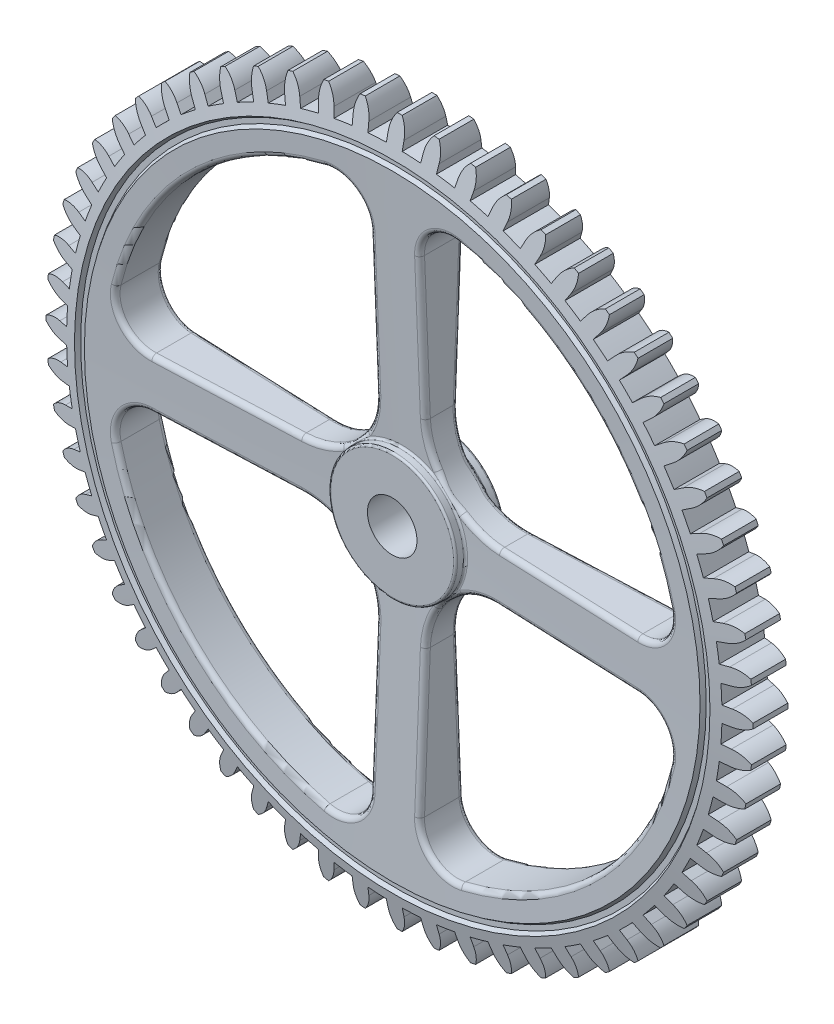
SolidWorks part; units mm, degrees
ref_plane "Front Plane" through (0, 0, 0) normal (0, 0, 1) x (1, 0, 0)
ref_plane "Top Plane" through (0, 0, 0) normal (0, 1, 0) x (1, 0, 0)
ref_plane "Right Plane" through (0, 0, 0) normal (1, 0, 0) x (0, 0, -1)
sketch "Sketch1" plane through (0, 0, 0) normal (1, 0, 0) x (0, 0, -1)
  line L0 (-5, 0) -> (5, 0)
  line L1 (-3.5, 71.3) -> (-5, 64.1)
  line L2 (3.5, 71.3) -> (-3.5, 71.3)
  line L3 (-5, 12.8) -> (-5, 0)
  line L4 (3.5, 71.3) -> (5, 64.1)
  line L5 (-5, 12.8) -> (-3, 12.8)
  line L6 (5, 62.1) -> (3, 12.8)
  line L7 (-4.2534, 63.6) -> (-4.2534, 62.6)
  line L8 (-5, 62.1) -> (-4.2534, 62.6)
  line L9 (-5, 64.1) -> (-4.2534, 63.6)
  line L10 (-5, 62.1) -> (-3, 12.8)
  line L11 (5, 12.8) -> (5, 0)
  line L12 (5, 62.1) -> (4.2534, 62.6)
  line L13 (4.2534, 63.6) -> (4.2534, 62.6)
  line L14 (5, 64.1) -> (4.2534, 63.6)
  line L15 (3, 12.8) -> (5, 12.8)
  line L16 (-5, 12.8) -> (5, 12.8) construction
  point P12 (-3, 12.8)
  dimension "D1" = 7
  dimension "D2" = 5
  dimension "D4" = 1.5
  dimension "D3" = 71.3
  dimension "D6" = 2
  dimension "D7" = 1
  dimension "D8" = 0.5
  dimension "D10" = 2
  dimension "D5" = 12.8
revolve "Revolve1" add sketch "Sketch1" angle 360 about L0
sketch "Sketch2" plane through (0, 0, 0) normal (0, 0, 1) x (1, 0, 0)
  line L0 (0.51, 71.2982) -> (-0.51, 71.2982)
  line L1 (5.499, 67.6268) -> (5.3161, 65.8859)
  line L2 (-1.6, 67.8311) -> (-1.6, 66.0806)
  line L3 (1.6, 67.8311) -> (1.6, 66.0806)
  line L4 (7.9599, 70.8543) -> (6.9455, 70.9609)
  line L5 (8.6815, 67.2923) -> (8.4985, 65.5514)
  line L6 (12.5378, 66.6815) -> (12.1739, 64.9693)
  line L7 (15.3226, 69.6341) -> (14.3249, 69.8462)
  line L8 (15.6679, 66.0162) -> (15.304, 64.304)
  line L9 (19.4393, 65.0057) -> (18.8983, 63.3408)
  line L10 (22.5174, 67.651) -> (21.5473, 67.9662)
  line L11 (22.4827, 64.0168) -> (21.9417, 62.352)
  line L12 (26.1277, 62.6176) -> (25.4157, 61.0184)
  line L13 (29.4655, 64.9267) -> (28.5337, 65.3416)
  line L14 (29.0511, 61.316) -> (28.3391, 59.7169)
  line L15 (32.5299, 59.5435) -> (31.6547, 58.0275)
  line L16 (36.0908, 61.491) -> (35.2074, 62.001)
  line L17 (35.3012, 57.9435) -> (34.426, 56.4275)
  line L18 (38.5757, 55.817) -> (37.5468, 54.4008)
  line L19 (42.3206, 57.3817) -> (41.4954, 57.9812)
  line L20 (41.1646, 53.9361) -> (40.1356, 52.5199)
  line L21 (44.1989, 51.479) -> (43.0275, 50.1781)
  line L22 (48.0868, 52.6436) -> (47.3288, 53.3261)
  line L23 (46.5769, 49.3377) -> (45.4056, 48.0369)
  line L24 (49.3377, 46.5769) -> (48.0369, 45.4056)
  line L25 (53.3261, 47.3288) -> (52.6436, 48.0868)
  line L26 (51.479, 44.1989) -> (50.1781, 43.0275)
  line L27 (53.9361, 41.1646) -> (52.5199, 40.1356)
  line L28 (57.9812, 41.4954) -> (57.3817, 42.3206)
  line L29 (55.817, 38.5757) -> (54.4008, 37.5468)
  line L30 (57.9435, 35.3012) -> (56.4275, 34.426)
  line L31 (62.001, 35.2074) -> (61.491, 36.0908)
  line L32 (59.5435, 32.5299) -> (58.0275, 31.6547)
  line L33 (61.316, 29.0511) -> (59.7169, 28.3391)
  line L34 (65.3416, 28.5337) -> (64.9267, 29.4655)
  line L35 (62.6176, 26.1277) -> (61.0184, 25.4157)
  line L36 (64.0168, 22.4827) -> (62.352, 21.9417)
  line L37 (67.9662, 21.5473) -> (67.651, 22.5174)
  line L38 (65.0057, 19.4393) -> (63.3408, 18.8983)
  line L39 (66.0162, 15.6679) -> (64.304, 15.304)
  line L40 (69.8462, 14.3249) -> (69.6341, 15.3226)
  line L41 (66.6815, 12.5378) -> (64.9693, 12.1739)
  line L42 (67.2923, 8.6815) -> (65.5514, 8.4985)
  line L43 (70.9609, 6.9455) -> (70.8543, 7.9599)
  line L44 (67.6268, 5.499) -> (65.8859, 5.3161)
  line L45 (67.8311, 1.6) -> (66.0806, 1.6)
  line L46 (71.2982, -0.51) -> (71.2982, 0.51)
  line L47 (67.8311, -1.6) -> (66.0806, -1.6)
  line L48 (67.6268, -5.499) -> (65.8859, -5.3161)
  line L49 (70.8543, -7.9599) -> (70.9609, -6.9455)
  line L50 (67.2923, -8.6815) -> (65.5514, -8.4985)
  line L51 (66.6815, -12.5378) -> (64.9693, -12.1739)
  line L52 (69.6341, -15.3226) -> (69.8462, -14.3249)
  line L53 (66.0162, -15.6679) -> (64.304, -15.304)
  line L54 (65.0057, -19.4393) -> (63.3408, -18.8983)
  line L55 (67.651, -22.5174) -> (67.9662, -21.5473)
  line L56 (64.0168, -22.4827) -> (62.352, -21.9417)
  line L57 (62.6176, -26.1277) -> (61.0184, -25.4157)
  line L58 (64.9267, -29.4655) -> (65.3416, -28.5337)
  line L59 (61.316, -29.0511) -> (59.7169, -28.3391)
  line L60 (59.5435, -32.5299) -> (58.0275, -31.6547)
  line L61 (61.491, -36.0908) -> (62.001, -35.2074)
  line L62 (57.9435, -35.3012) -> (56.4275, -34.426)
  line L63 (55.817, -38.5757) -> (54.4008, -37.5468)
  line L64 (57.3817, -42.3206) -> (57.9812, -41.4954)
  line L65 (53.9361, -41.1646) -> (52.5199, -40.1356)
  line L66 (51.479, -44.1989) -> (50.1781, -43.0275)
  line L67 (52.6436, -48.0868) -> (53.3261, -47.3288)
  line L68 (49.3377, -46.5769) -> (48.0369, -45.4056)
  line L69 (46.5769, -49.3377) -> (45.4056, -48.0369)
  line L70 (47.3288, -53.3261) -> (48.0868, -52.6436)
  line L71 (44.1989, -51.479) -> (43.0275, -50.1781)
  line L72 (41.1646, -53.9361) -> (40.1356, -52.5199)
  line L73 (41.4954, -57.9812) -> (42.3206, -57.3817)
  line L74 (38.5757, -55.817) -> (37.5468, -54.4008)
  line L75 (35.3012, -57.9435) -> (34.426, -56.4275)
  line L76 (35.2074, -62.001) -> (36.0908, -61.491)
  line L77 (32.5299, -59.5435) -> (31.6547, -58.0275)
  line L78 (29.0511, -61.316) -> (28.3391, -59.7169)
  line L79 (28.5337, -65.3416) -> (29.4655, -64.9267)
  line L80 (26.1277, -62.6176) -> (25.4157, -61.0184)
  line L81 (22.4827, -64.0168) -> (21.9417, -62.352)
  line L82 (21.5473, -67.9662) -> (22.5174, -67.651)
  line L83 (19.4393, -65.0057) -> (18.8983, -63.3408)
  line L84 (15.6679, -66.0162) -> (15.304, -64.304)
  line L85 (14.3249, -69.8462) -> (15.3226, -69.6341)
  line L86 (12.5378, -66.6815) -> (12.1739, -64.9693)
  line L87 (8.6815, -67.2923) -> (8.4985, -65.5514)
  line L88 (6.9455, -70.9609) -> (7.9599, -70.8543)
  line L89 (5.499, -67.6268) -> (5.3161, -65.8859)
  line L90 (1.6, -67.8311) -> (1.6, -66.0806)
  line L91 (-0.51, -71.2982) -> (0.51, -71.2982)
  line L92 (-1.6, -67.8311) -> (-1.6, -66.0806)
  line L93 (-5.499, -67.6268) -> (-5.3161, -65.8859)
  line L94 (-7.9599, -70.8543) -> (-6.9455, -70.9609)
  line L95 (-8.6815, -67.2923) -> (-8.4985, -65.5514)
  line L96 (-12.5378, -66.6815) -> (-12.1739, -64.9693)
  line L97 (-15.3226, -69.6341) -> (-14.3249, -69.8462)
  line L98 (-15.6679, -66.0162) -> (-15.304, -64.304)
  line L99 (-19.4393, -65.0057) -> (-18.8983, -63.3408)
  line L100 (-22.5174, -67.651) -> (-21.5473, -67.9662)
  line L101 (-22.4827, -64.0168) -> (-21.9417, -62.352)
  line L102 (-26.1277, -62.6176) -> (-25.4157, -61.0184)
  line L103 (-29.4655, -64.9267) -> (-28.5337, -65.3416)
  line L104 (-29.0511, -61.316) -> (-28.3391, -59.7169)
  line L105 (-32.5299, -59.5435) -> (-31.6547, -58.0275)
  line L106 (-36.0908, -61.491) -> (-35.2074, -62.001)
  line L107 (-35.3012, -57.9435) -> (-34.426, -56.4275)
  line L108 (-38.5757, -55.817) -> (-37.5468, -54.4008)
  line L109 (-42.3206, -57.3817) -> (-41.4954, -57.9812)
  line L110 (-41.1646, -53.9361) -> (-40.1356, -52.5199)
  line L111 (-44.1989, -51.479) -> (-43.0275, -50.1781)
  line L112 (-48.0868, -52.6436) -> (-47.3288, -53.3261)
  line L113 (-46.5769, -49.3377) -> (-45.4056, -48.0369)
  line L114 (-49.3377, -46.5769) -> (-48.0369, -45.4056)
  line L115 (-53.3261, -47.3288) -> (-52.6436, -48.0868)
  line L116 (-51.479, -44.1989) -> (-50.1781, -43.0275)
  line L117 (-53.9361, -41.1646) -> (-52.5199, -40.1356)
  line L118 (-57.9812, -41.4954) -> (-57.3817, -42.3206)
  line L119 (-55.817, -38.5757) -> (-54.4008, -37.5468)
  line L120 (-57.9435, -35.3012) -> (-56.4275, -34.426)
  line L121 (-62.001, -35.2074) -> (-61.491, -36.0908)
  line L122 (-59.5435, -32.5299) -> (-58.0275, -31.6547)
  line L123 (-61.316, -29.0511) -> (-59.7169, -28.3391)
  line L124 (-65.3416, -28.5337) -> (-64.9267, -29.4655)
  line L125 (-62.6176, -26.1277) -> (-61.0184, -25.4157)
  line L126 (-64.0168, -22.4827) -> (-62.352, -21.9417)
  line L127 (-67.9662, -21.5473) -> (-67.651, -22.5174)
  line L128 (-65.0057, -19.4393) -> (-63.3408, -18.8983)
  line L129 (-66.0162, -15.6679) -> (-64.304, -15.304)
  line L130 (-69.8462, -14.3249) -> (-69.6341, -15.3226)
  line L131 (-66.6815, -12.5378) -> (-64.9693, -12.1739)
  line L132 (-67.2923, -8.6815) -> (-65.5514, -8.4985)
  line L133 (-70.9609, -6.9455) -> (-70.8543, -7.9599)
  line L134 (-67.6268, -5.499) -> (-65.8859, -5.3161)
  line L135 (-67.8311, -1.6) -> (-66.0806, -1.6)
  line L136 (-71.2982, 0.51) -> (-71.2982, -0.51)
  line L137 (-67.8311, 1.6) -> (-66.0806, 1.6)
  line L138 (-67.6268, 5.499) -> (-65.8859, 5.3161)
  line L139 (-70.8543, 7.9599) -> (-70.9609, 6.9455)
  line L140 (-67.2923, 8.6815) -> (-65.5514, 8.4985)
  line L141 (-66.6815, 12.5378) -> (-64.9693, 12.1739)
  line L142 (-69.6341, 15.3226) -> (-69.8462, 14.3249)
  line L143 (-66.0162, 15.6679) -> (-64.304, 15.304)
  line L144 (-65.0057, 19.4393) -> (-63.3408, 18.8983)
  line L145 (-67.651, 22.5174) -> (-67.9662, 21.5473)
  line L146 (-64.0168, 22.4827) -> (-62.352, 21.9417)
  line L147 (-62.6176, 26.1277) -> (-61.0184, 25.4157)
  line L148 (-64.9267, 29.4655) -> (-65.3416, 28.5337)
  line L149 (-61.316, 29.0511) -> (-59.7169, 28.3391)
  line L150 (-59.5435, 32.5299) -> (-58.0275, 31.6547)
  line L151 (-61.491, 36.0908) -> (-62.001, 35.2074)
  line L152 (-57.9435, 35.3012) -> (-56.4275, 34.426)
  line L153 (-55.817, 38.5757) -> (-54.4008, 37.5468)
  line L154 (-57.3817, 42.3206) -> (-57.9812, 41.4954)
  line L155 (-53.9361, 41.1646) -> (-52.5199, 40.1356)
  line L156 (-51.479, 44.1989) -> (-50.1781, 43.0275)
  line L157 (-52.6436, 48.0868) -> (-53.3261, 47.3288)
  line L158 (-49.3377, 46.5769) -> (-48.0369, 45.4056)
  line L159 (-46.5769, 49.3377) -> (-45.4056, 48.0369)
  line L160 (-47.3288, 53.3261) -> (-48.0868, 52.6436)
  line L161 (-44.1989, 51.479) -> (-43.0275, 50.1781)
  line L162 (-41.1646, 53.9361) -> (-40.1356, 52.5199)
  line L163 (-41.4954, 57.9812) -> (-42.3206, 57.3817)
  line L164 (-38.5757, 55.817) -> (-37.5468, 54.4008)
  line L165 (-35.3012, 57.9435) -> (-34.426, 56.4275)
  line L166 (-35.2074, 62.001) -> (-36.0908, 61.491)
  line L167 (-32.5299, 59.5435) -> (-31.6547, 58.0275)
  line L168 (-29.0511, 61.316) -> (-28.3391, 59.7169)
  line L169 (-28.5337, 65.3416) -> (-29.4655, 64.9267)
  line L170 (-26.1277, 62.6176) -> (-25.4157, 61.0184)
  line L171 (-22.4827, 64.0168) -> (-21.9417, 62.352)
  line L172 (-21.5473, 67.9662) -> (-22.5174, 67.651)
  line L173 (-19.4393, 65.0057) -> (-18.8983, 63.3408)
  line L174 (-15.6679, 66.0162) -> (-15.304, 64.304)
  line L175 (-14.3249, 69.8462) -> (-15.3226, 69.6341)
  line L176 (-12.5378, 66.6815) -> (-12.1739, 64.9693)
  line L177 (-8.6815, 67.2923) -> (-8.4985, 65.5514)
  line L178 (-6.9455, 70.9609) -> (-7.9599, 70.8543)
  line L179 (-5.499, 67.6268) -> (-5.3161, 65.8859)
  arc A0 (6.9455, 70.9609) -> (5.499, 67.6268) centre (11.4681, 67.0181) ccw
  arc A1 (-1.6, 66.0806) -> (1.6, 66.0806) centre (0, 0) ccw
  circle A2 centre (0, 0) radius 71.3 construction
  arc A3 (-0.51, 71.2982) -> (-1.6, 67.8311) centre (4.4, 67.8497) ccw
  arc A4 (0.51, 71.2982) -> (1.6, 67.8311) centre (-4.4, 67.8497) cw
  arc A5 (7.9599, 70.8543) -> (8.6815, 67.2923) centre (2.7164, 67.9379) cw
  arc A6 (14.3249, 69.8462) -> (12.5378, 66.6815) centre (18.4106, 65.4522) ccw
  arc A7 (15.3226, 69.6341) -> (15.6679, 66.0162) centre (9.8029, 67.2818) cw
  arc A8 (21.5473, 67.9662) -> (19.4393, 65.0057) centre (25.1513, 63.1692) ccw
  arc A9 (22.5174, 67.651) -> (22.4827, 64.0168) centre (16.7821, 65.8885) cw
  arc A10 (28.5337, 65.3416) -> (26.1277, 62.6176) centre (31.6165, 60.1941) ccw
  arc A11 (29.4655, 64.9267) -> (29.0511, 61.316) centre (23.5774, 63.7734) cw
  arc A12 (35.2074, 62.001) -> (32.5299, 59.5435) centre (37.7353, 56.5596) ccw
  arc A13 (36.0908, 61.491) -> (35.3012, 57.9435) centre (30.1143, 60.9595) cw
  arc A14 (41.4954, 57.9812) -> (38.5757, 55.817) centre (43.4407, 52.3053) ccw
  arc A15 (42.3206, 57.3817) -> (41.1646, 53.9361) centre (36.3214, 57.4778) cw
  arc A16 (47.3288, 53.3261) -> (44.1989, 51.479) centre (48.6701, 47.478) ccw
  arc A17 (48.0868, 52.6436) -> (46.5769, 49.3377) centre (42.1305, 53.3663) cw
  arc A18 (52.6436, 48.0868) -> (49.3377, 46.5769) centre (53.3663, 42.1305) ccw
  arc A19 (53.3261, 47.3288) -> (51.479, 44.1989) centre (47.478, 48.6701) cw
  arc A20 (57.3817, 42.3206) -> (53.9361, 41.1646) centre (57.4778, 36.3214) ccw
  arc A21 (57.9812, 41.4954) -> (55.817, 38.5757) centre (52.3053, 43.4407) cw
  arc A22 (61.491, 36.0908) -> (57.9435, 35.3012) centre (60.9595, 30.1143) ccw
  arc A23 (62.001, 35.2074) -> (59.5435, 32.5299) centre (56.5596, 37.7353) cw
  arc A24 (64.9267, 29.4655) -> (61.316, 29.0511) centre (63.7734, 23.5774) ccw
  arc A25 (65.3416, 28.5337) -> (62.6176, 26.1277) centre (60.1941, 31.6165) cw
  arc A26 (67.651, 22.5174) -> (64.0168, 22.4827) centre (65.8885, 16.7821) ccw
  arc A27 (67.9662, 21.5473) -> (65.0057, 19.4393) centre (63.1692, 25.1513) cw
  arc A28 (69.6341, 15.3226) -> (66.0162, 15.6679) centre (67.2818, 9.8029) ccw
  arc A29 (69.8462, 14.3249) -> (66.6815, 12.5378) centre (65.4522, 18.4106) cw
  arc A30 (70.8543, 7.9599) -> (67.2923, 8.6815) centre (67.9379, 2.7164) ccw
  arc A31 (70.9609, 6.9455) -> (67.6268, 5.499) centre (67.0181, 11.4681) cw
  arc A32 (71.2982, 0.51) -> (67.8311, 1.6) centre (67.8497, -4.4) ccw
  arc A33 (71.2982, -0.51) -> (67.8311, -1.6) centre (67.8497, 4.4) cw
  arc A34 (70.9609, -6.9455) -> (67.6268, -5.499) centre (67.0181, -11.4681) ccw
  arc A35 (70.8543, -7.9599) -> (67.2923, -8.6815) centre (67.9379, -2.7164) cw
  arc A36 (69.8462, -14.3249) -> (66.6815, -12.5378) centre (65.4522, -18.4106) ccw
  arc A37 (69.6341, -15.3226) -> (66.0162, -15.6679) centre (67.2818, -9.8029) cw
  arc A38 (67.9662, -21.5473) -> (65.0057, -19.4393) centre (63.1692, -25.1513) ccw
  arc A39 (67.651, -22.5174) -> (64.0168, -22.4827) centre (65.8885, -16.7821) cw
  arc A40 (65.3416, -28.5337) -> (62.6176, -26.1277) centre (60.1941, -31.6165) ccw
  arc A41 (64.9267, -29.4655) -> (61.316, -29.0511) centre (63.7734, -23.5774) cw
  arc A42 (62.001, -35.2074) -> (59.5435, -32.5299) centre (56.5596, -37.7353) ccw
  arc A43 (61.491, -36.0908) -> (57.9435, -35.3012) centre (60.9595, -30.1143) cw
  arc A44 (57.9812, -41.4954) -> (55.817, -38.5757) centre (52.3053, -43.4407) ccw
  arc A45 (57.3817, -42.3206) -> (53.9361, -41.1646) centre (57.4778, -36.3214) cw
  arc A46 (53.3261, -47.3288) -> (51.479, -44.1989) centre (47.478, -48.6701) ccw
  arc A47 (52.6436, -48.0868) -> (49.3377, -46.5769) centre (53.3663, -42.1305) cw
  arc A48 (48.0868, -52.6436) -> (46.5769, -49.3377) centre (42.1305, -53.3663) ccw
  arc A49 (47.3288, -53.3261) -> (44.1989, -51.479) centre (48.6701, -47.478) cw
  arc A50 (42.3206, -57.3817) -> (41.1646, -53.9361) centre (36.3214, -57.4778) ccw
  arc A51 (41.4954, -57.9812) -> (38.5757, -55.817) centre (43.4407, -52.3053) cw
  arc A52 (36.0908, -61.491) -> (35.3012, -57.9435) centre (30.1143, -60.9595) ccw
  arc A53 (35.2074, -62.001) -> (32.5299, -59.5435) centre (37.7353, -56.5596) cw
  arc A54 (29.4655, -64.9267) -> (29.0511, -61.316) centre (23.5774, -63.7734) ccw
  arc A55 (28.5337, -65.3416) -> (26.1277, -62.6176) centre (31.6165, -60.1941) cw
  arc A56 (22.5174, -67.651) -> (22.4827, -64.0168) centre (16.7821, -65.8885) ccw
  arc A57 (21.5473, -67.9662) -> (19.4393, -65.0057) centre (25.1513, -63.1692) cw
  arc A58 (15.3226, -69.6341) -> (15.6679, -66.0162) centre (9.8029, -67.2818) ccw
  arc A59 (14.3249, -69.8462) -> (12.5378, -66.6815) centre (18.4106, -65.4522) cw
  arc A60 (7.9599, -70.8543) -> (8.6815, -67.2923) centre (2.7164, -67.9379) ccw
  arc A61 (6.9455, -70.9609) -> (5.499, -67.6268) centre (11.4681, -67.0181) cw
  arc A62 (0.51, -71.2982) -> (1.6, -67.8311) centre (-4.4, -67.8497) ccw
  arc A63 (-0.51, -71.2982) -> (-1.6, -67.8311) centre (4.4, -67.8497) cw
  arc A64 (-6.9455, -70.9609) -> (-5.499, -67.6268) centre (-11.4681, -67.0181) ccw
  arc A65 (-7.9599, -70.8543) -> (-8.6815, -67.2923) centre (-2.7164, -67.9379) cw
  arc A66 (-14.3249, -69.8462) -> (-12.5378, -66.6815) centre (-18.4106, -65.4522) ccw
  arc A67 (-15.3226, -69.6341) -> (-15.6679, -66.0162) centre (-9.8029, -67.2818) cw
  arc A68 (-21.5473, -67.9662) -> (-19.4393, -65.0057) centre (-25.1513, -63.1692) ccw
  arc A69 (-22.5174, -67.651) -> (-22.4827, -64.0168) centre (-16.7821, -65.8885) cw
  arc A70 (-28.5337, -65.3416) -> (-26.1277, -62.6176) centre (-31.6165, -60.1941) ccw
  arc A71 (-29.4655, -64.9267) -> (-29.0511, -61.316) centre (-23.5774, -63.7734) cw
  arc A72 (-35.2074, -62.001) -> (-32.5299, -59.5435) centre (-37.7353, -56.5596) ccw
  arc A73 (-36.0908, -61.491) -> (-35.3012, -57.9435) centre (-30.1143, -60.9595) cw
  arc A74 (-41.4954, -57.9812) -> (-38.5757, -55.817) centre (-43.4407, -52.3053) ccw
  arc A75 (-42.3206, -57.3817) -> (-41.1646, -53.9361) centre (-36.3214, -57.4778) cw
  arc A76 (-47.3288, -53.3261) -> (-44.1989, -51.479) centre (-48.6701, -47.478) ccw
  arc A77 (-48.0868, -52.6436) -> (-46.5769, -49.3377) centre (-42.1305, -53.3663) cw
  arc A78 (-52.6436, -48.0868) -> (-49.3377, -46.5769) centre (-53.3663, -42.1305) ccw
  arc A79 (-53.3261, -47.3288) -> (-51.479, -44.1989) centre (-47.478, -48.6701) cw
  arc A80 (-57.3817, -42.3206) -> (-53.9361, -41.1646) centre (-57.4778, -36.3214) ccw
  arc A81 (-57.9812, -41.4954) -> (-55.817, -38.5757) centre (-52.3053, -43.4407) cw
  arc A82 (-61.491, -36.0908) -> (-57.9435, -35.3012) centre (-60.9595, -30.1143) ccw
  arc A83 (-62.001, -35.2074) -> (-59.5435, -32.5299) centre (-56.5596, -37.7353) cw
  arc A84 (-64.9267, -29.4655) -> (-61.316, -29.0511) centre (-63.7734, -23.5774) ccw
  arc A85 (-65.3416, -28.5337) -> (-62.6176, -26.1277) centre (-60.1941, -31.6165) cw
  arc A86 (-67.651, -22.5174) -> (-64.0168, -22.4827) centre (-65.8885, -16.7821) ccw
  arc A87 (-67.9662, -21.5473) -> (-65.0057, -19.4393) centre (-63.1692, -25.1513) cw
  arc A88 (-69.6341, -15.3226) -> (-66.0162, -15.6679) centre (-67.2818, -9.8029) ccw
  arc A89 (-69.8462, -14.3249) -> (-66.6815, -12.5378) centre (-65.4522, -18.4106) cw
  arc A90 (-70.8543, -7.9599) -> (-67.2923, -8.6815) centre (-67.9379, -2.7164) ccw
  arc A91 (-70.9609, -6.9455) -> (-67.6268, -5.499) centre (-67.0181, -11.4681) cw
  arc A92 (-71.2982, -0.51) -> (-67.8311, -1.6) centre (-67.8497, 4.4) ccw
  arc A93 (-71.2982, 0.51) -> (-67.8311, 1.6) centre (-67.8497, -4.4) cw
  arc A94 (-70.9609, 6.9455) -> (-67.6268, 5.499) centre (-67.0181, 11.4681) ccw
  arc A95 (-70.8543, 7.9599) -> (-67.2923, 8.6815) centre (-67.9379, 2.7164) cw
  arc A96 (-69.8462, 14.3249) -> (-66.6815, 12.5378) centre (-65.4522, 18.4106) ccw
  arc A97 (-69.6341, 15.3226) -> (-66.0162, 15.6679) centre (-67.2818, 9.8029) cw
  arc A98 (-67.9662, 21.5473) -> (-65.0057, 19.4393) centre (-63.1692, 25.1513) ccw
  arc A99 (-67.651, 22.5174) -> (-64.0168, 22.4827) centre (-65.8885, 16.7821) cw
  arc A100 (-65.3416, 28.5337) -> (-62.6176, 26.1277) centre (-60.1941, 31.6165) ccw
  arc A101 (-64.9267, 29.4655) -> (-61.316, 29.0511) centre (-63.7734, 23.5774) cw
  arc A102 (-62.001, 35.2074) -> (-59.5435, 32.5299) centre (-56.5596, 37.7353) ccw
  arc A103 (-61.491, 36.0908) -> (-57.9435, 35.3012) centre (-60.9595, 30.1143) cw
  arc A104 (-57.9812, 41.4954) -> (-55.817, 38.5757) centre (-52.3053, 43.4407) ccw
  arc A105 (-57.3817, 42.3206) -> (-53.9361, 41.1646) centre (-57.4778, 36.3214) cw
  arc A106 (-53.3261, 47.3288) -> (-51.479, 44.1989) centre (-47.478, 48.6701) ccw
  arc A107 (-52.6436, 48.0868) -> (-49.3377, 46.5769) centre (-53.3663, 42.1305) cw
  arc A108 (-48.0868, 52.6436) -> (-46.5769, 49.3377) centre (-42.1305, 53.3663) ccw
  arc A109 (-47.3288, 53.3261) -> (-44.1989, 51.479) centre (-48.6701, 47.478) cw
  arc A110 (-42.3206, 57.3817) -> (-41.1646, 53.9361) centre (-36.3214, 57.4778) ccw
  arc A111 (-41.4954, 57.9812) -> (-38.5757, 55.817) centre (-43.4407, 52.3053) cw
  arc A112 (-36.0908, 61.491) -> (-35.3012, 57.9435) centre (-30.1143, 60.9595) ccw
  arc A113 (-35.2074, 62.001) -> (-32.5299, 59.5435) centre (-37.7353, 56.5596) cw
  arc A114 (-29.4655, 64.9267) -> (-29.0511, 61.316) centre (-23.5774, 63.7734) ccw
  arc A115 (-28.5337, 65.3416) -> (-26.1277, 62.6176) centre (-31.6165, 60.1941) cw
  arc A116 (-22.5174, 67.651) -> (-22.4827, 64.0168) centre (-16.7821, 65.8885) ccw
  arc A117 (-21.5473, 67.9662) -> (-19.4393, 65.0057) centre (-25.1513, 63.1692) cw
  arc A118 (-15.3226, 69.6341) -> (-15.6679, 66.0162) centre (-9.8029, 67.2818) ccw
  arc A119 (-14.3249, 69.8462) -> (-12.5378, 66.6815) centre (-18.4106, 65.4522) cw
  arc A120 (-7.9599, 70.8543) -> (-8.6815, 67.2923) centre (-2.7164, 67.9379) ccw
  arc A121 (-6.9455, 70.9609) -> (-5.499, 67.6268) centre (-11.4681, 67.0181) cw
  circle A122 centre (0, 0) radius 71.3
  point P9 (0, 71.2982)
  point P487 (0, 0)
  dimension "D1" = 60
  dimension "D2" = 132.2
  dimension "D7" = 6
  dimension "D8" = 6
  dimension "D3" = 1.02
  dimension "D4" = 0.51
extrude "Cut-Extrude2" cut sketch "Sketch2" against normal through all both and the other way through all contours A114 A122 A113 L167 A1 L168 | A116 A122 A115 L170 A1 L171 | A118 A122 A117 L173 A1 L174 | A120 A122 A119 L176 A1 L177 | A3 A122 A121 L179 A1 L2 | A0 A122 A4 L3 A1 L1 | A6 A122 A5 L5 A1 L6 | A8 A122 A7 L8 A1 L9 | A10 A122 A9 L11 A1 L12 | A12 A122 A11 L14 A1 L15 | A14 A122 A13 L17 A1 L18 | A16 A122 A15 L20 A1 L21 | A18 A122 A17 L23 A1 L24 | A20 A122 A19 L26 A1 L27 | A22 A122 A21 L29 A1 L30 | A24 A122 A23 L32 A1 L33 | A26 A122 A25 L35 A1 L36 | A28 A122 A27 L38 A1 L39 | A30 A122 A29 L41 A1 L42 | A32 A122 A31 L44 A1 L45 | A34 A122 A33 L47 A1 L48 | A36 A122 A35 L50 A1 L51 | A38 A122 A37 L53 A1 L54 | A40 A122 A39 L56 A1 L57 | A42 A122 A41 L59 A1 L60 | A44 A122 A43 L62 A1 L63 | A46 A122 A45 L65 A1 L66 | A48 A122 A47 L68 A1 L69 | A50 A122 A49 L71 A1 L72 | A52 A122 A51 L74 A1 L75 | A54 A122 A53 L77 A1 L78 | A56 A122 A55 L80 A1 L81 | A58 A122 A57 L83 A1 L84 | A60 A122 A59 L86 A1 L87 | A62 A122 A61 L89 A1 L90 | A64 A122 A63 L92 A1 L93 | A66 A122 A65 L95 A1 L96 | A68 A122 A67 L98 A1 L99 | A70 A122 A69 L101 A1 L102 | A72 A122 A71 L104 A1 L105 | A74 A122 A73 L107 A1 L108 | A76 A122 A75 L110 A1 L111 | A78 A122 A77 L113 A1 L114 | A80 A122 A79 L116 A1 L117 | A82 A122 A81 L119 A1 L120 | A84 A122 A83 L122 A1 L123 | A86 A122 A85 L125 A1 L126 | A88 A122 A87 L128 A1 L129 | A90 A122 A89 L131 A1 L132 | A92 A122 A91 L134 A1 L135 | A94 A122 A93 L137 A1 L138 | A96 A122 A95 L140 A1 L141 | A98 A122 A97 L143 A1 L144 | A100 A122 A99 L146 A1 L147 | A102 A122 A101 L149 A1 L150 | A104 A122 A103 L152 A1 L153 | A106 A122 A105 L155 A1 L156 | A108 A122 A107 L158 A1 L159 | A110 A122 A109 L161 A1 L162 | A112 A122 A111 L164 A1 L165
sketch "Sketch3" plane through (0, 0, 0) normal (0, 0, 1) x (1, 0, 0)
  line L0 (20, -5) -> (49.0535, -5)
  line L1 (5, -20) -> (5, -49.0535)
  line L2 (5, 20) -> (5, 49.0535)
  line L3 (20, 5) -> (49.0535, 5)
  line L4 (-5, -20) -> (-5, -49.0535)
  line L5 (-20, -5) -> (-49.0535, -5)
  line L6 (-20, 5) -> (-49.0535, 5)
  line L7 (-5, 20) -> (-5, 49.0535)
  arc A0 (49.0535, -5) -> (55.853, -13.6634) centre (49.0535, -12) cw
  arc A1 (55.853, 13.6634) -> (13.6634, 55.853) centre (0, 0) ccw
  arc A2 (49.0535, 5) -> (55.853, 13.6634) centre (49.0535, 12) ccw
  arc A3 (5, 49.0535) -> (13.6634, 55.853) centre (12, 49.0535) cw
  arc A4 (5, 20) -> (20, 5) centre (20, 20) ccw
  arc A5 (13.6634, -55.853) -> (55.853, -13.6634) centre (0, 0) ccw
  arc A6 (5, -49.0535) -> (13.6634, -55.853) centre (12, -49.0535) ccw
  arc A7 (20, -5) -> (5, -20) centre (20, -20) ccw
  arc A8 (-5, -49.0535) -> (-13.6634, -55.853) centre (-12, -49.0535) cw
  arc A9 (-55.853, -13.6634) -> (-13.6634, -55.853) centre (0, 0) ccw
  arc A10 (-49.0535, -5) -> (-55.853, -13.6634) centre (-49.0535, -12) ccw
  arc A11 (-5, -20) -> (-20, -5) centre (-20, -20) ccw
  arc A12 (-49.0535, 5) -> (-55.853, 13.6634) centre (-49.0535, 12) cw
  arc A13 (-13.6634, 55.853) -> (-55.853, 13.6634) centre (0, 0) ccw
  arc A14 (-5, 49.0535) -> (-13.6634, 55.853) centre (-12, 49.0535) ccw
  arc A15 (-20, 5) -> (-5, 20) centre (-20, 20) ccw
  point P11 (57.2822, 5)
  point P42 (0, 0)
  dimension "D1" = 4
  dimension "D3" = 7
  dimension "D4" = 15
extrude "Cut-Extrude3" cut sketch "Sketch3" against normal through all both and the other way through all
fillet "Fillet6" radius 0.4 4 edges at (12.8, 0, -3) (12.8, 0, -5) (12.8, 0, 5) (12.8, 0, 3)
fillet "Fillet7" radius 1 48 edges at (10.472, 8.4148, 3.0257) (54.0713, 7.1192, 4.6932) (40.6586, 40.6586, 4.8134) (8.2941, 54.9921, 4.7369) (-7.1192, 54.0713, 4.6932) (-40.6586, 40.6586, 4.8134) (-54.9921, 8.2941, 4.7369) (-8.4148, 10.472, 3.0257) (7.1192, -54.0713, 4.6932) (40.6586, -40.6586, 4.8134) (54.9921, -8.2941, 4.7369) (8.4148, -10.472, 3.0257) (-10.472, -8.4148, 3.0257) (-54.0713, -7.1192, 4.6932) (-40.6586, -40.6586, 4.8134) (-8.2941, -54.9921, 4.7369) (54.9921, -8.2941, -4.7369) (8.4148, -10.472, -3.0257) (7.1192, -54.0713, -4.6932) (-10.472, -8.4148, -3.0257) (-54.0713, -7.1192, -4.6932) (-40.6586, -40.6586, -4.8134) (-8.2941, -54.9921, -4.7369) (10.472, 8.4148, -3.0257) (54.0713, 7.1192, -4.6932) (40.6586, 40.6586, -4.8134) (8.2941, 54.9921, -4.7369) (-7.1192, 54.0713, -4.6932) (-40.6586, 40.6586, -4.8134) (-54.9921, 8.2941, -4.7369) (-8.4148, 10.472, -3.0257) (40.6586, -40.6586, -4.8134)
sketch "Sketch4" plane through (0, 0, -5) normal (0, 0, -1) x (-1, 0, 0)
  circle A0 centre (0, 0) radius 5
  dimension "D1" = 10
extrude "Cut-Extrude5" cut sketch "Sketch4" against normal blind 40
